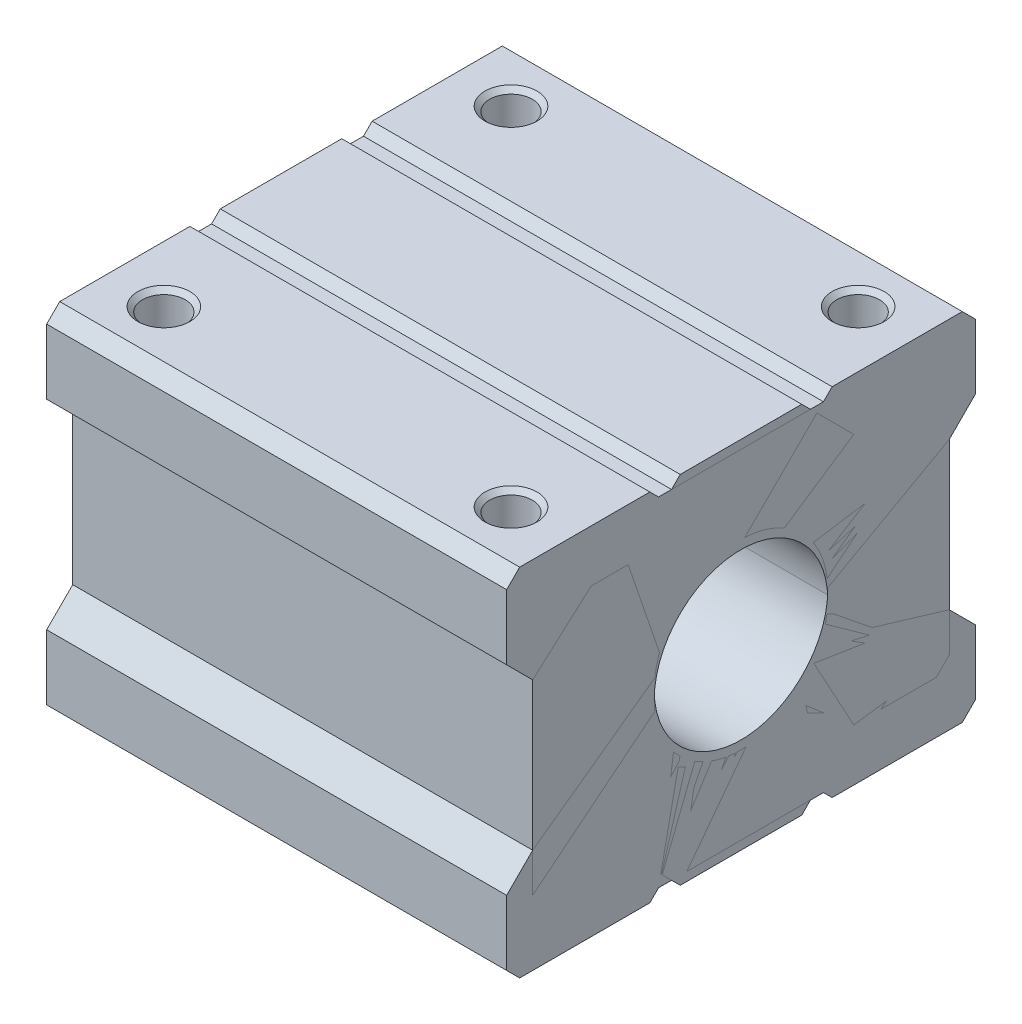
SolidWorks part; units mm, degrees
other "Solid2"
ref_plane "Front Plane" through (0, 0, 0) normal (0, 0, 1) x (1, 0, 0)
ref_plane "Top Plane" through (0, 0, 0) normal (0, 1, 0) x (1, 0, 0)
ref_plane "Right Plane" through (0, 0, 0) normal (1, 0, 0) x (0, 0, -1)
imported_body "2.7091 SCE20UU.stp<1>"
move or copy body "Body-Move/Copy1" bodies to move or copy 101 copy no rotation origin (0, 20.5, 0) rotation axis (1, 0, 0) rotation angle 180
